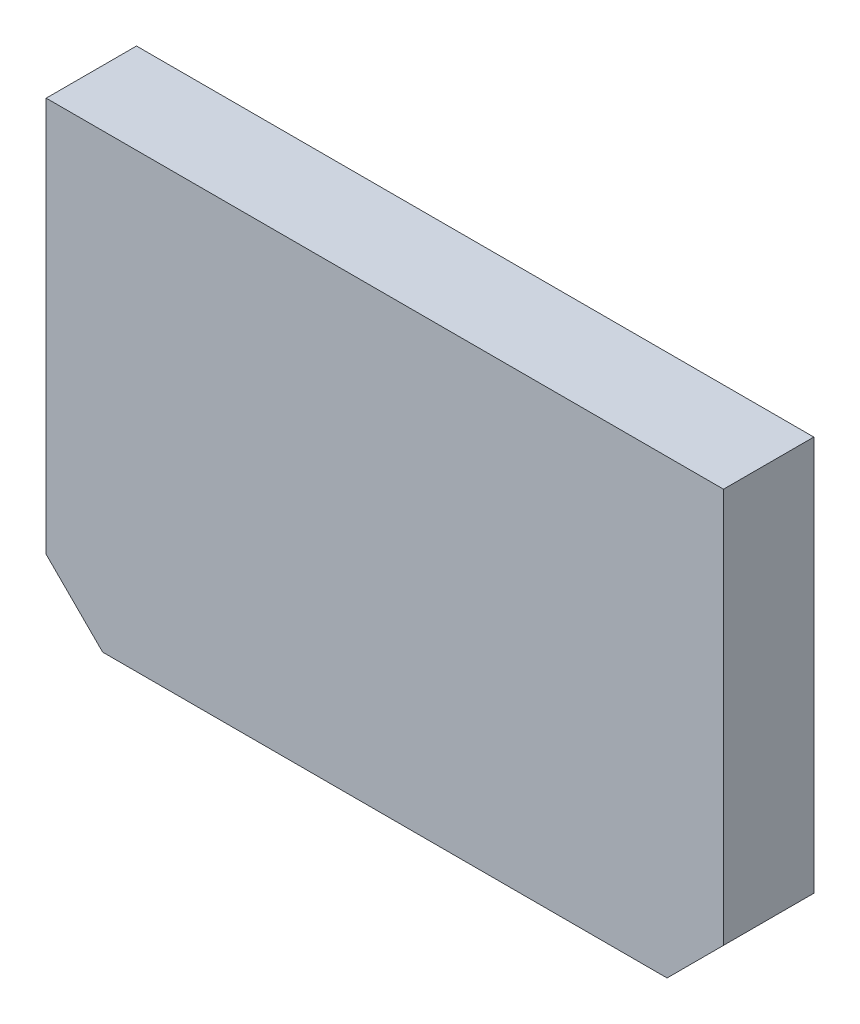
SolidWorks part; units mm, degrees
ref_plane "前视基准面" through (0, 0, 0) normal (0, 0, 1) x (1, 0, 0)
ref_plane "上视基准面" through (0, 0, 0) normal (0, 1, 0) x (1, 0, 0)
ref_plane "右视基准面" through (0, 0, 0) normal (1, 0, 0) x (0, 0, -1)
sketch "草图1" plane through (0, 0, 0) normal (0, 0, 1) x (1, 0, 0)
  line L1 (0, 0) -> (60, 0)
  line L2 (0, 0) -> (0, 40)
  line L3 (0, 40) -> (60, 40)
  line L4 (60, 0) -> (60, 40)
  dimension "D1" = 40
  dimension "D2" = 60
extrude "拉伸1" add sketch "草图1" along normal blind 8
chamfer "倒角1" distance 5 angle 45 2 edges at (0, 0, 4) (60, 0, 4)
